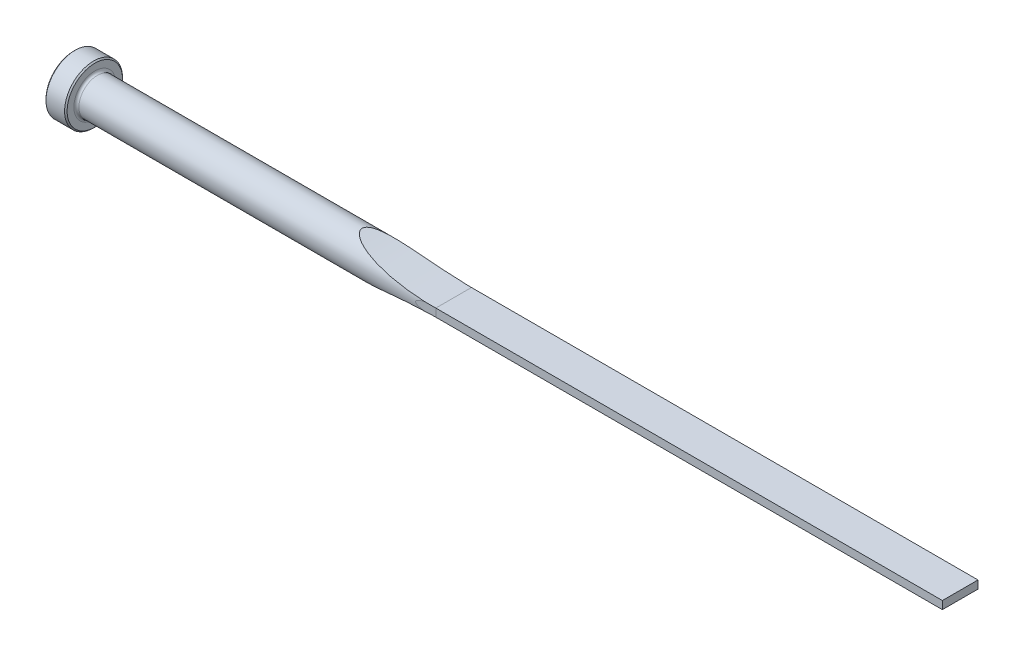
SolidWorks part; units mm, degrees
ref_plane "Front Plane" through (0, 0, 0) normal (0, 0, 1) x (1, 0, 0)
ref_plane "Top Plane" through (0, 0, 0) normal (0, 1, 0) x (1, 0, 0)
ref_plane "Right Plane" through (0, 0, 0) normal (1, 0, 0) x (0, 0, -1)
sketch "Sketch1" plane through (0, 0, 0) normal (0, 0, 1) x (1, 0, 0)
  line L0 (0, 0) -> (175.5286, 0) construction
  line L1 (0, 0) -> (0, 8.7249)
  line L2 (0, 8.7249) -> (6.35, 8.7249)
  line L3 (6.35, 8.7249) -> (6.35, 5.5562)
  line L4 (6.35, 5.5562) -> (266.7, 5.5562)
  line L5 (266.7, 5.5562) -> (266.7, 0)
  line L6 (266.7, 0) -> (0, 0)
  dimension "D1" = 266.7
  dimension "D2" = 17.4498
  dimension "D3" = 11.1125
  dimension "D4" = 6.35
revolve "Revolve1" add sketch "Sketch1" angle 360 about L0
sketch "Sketch2" plane through (0, 0, 0) normal (0, 0, 1) x (1, 0, 0)
  line L0 (266.7, 5.5562) -> (266.7, 1.1938)
  line L1 (266.7, -5.5562) -> (266.7, 5.5562) construction
  line L2 (266.7, 1.1938) -> (114.3, 1.1938)
  line L3 (266.7, 5.5562) -> (6.35, 5.5562) construction
  line L4 (86.7934, 5.5562) -> (266.7, 5.5562)
  line L5 (166.0833, 0) -> (153.1705, 0) construction
  arc A0 (114.3, 1.1938) -> (86.7934, 5.5562) centre (114.3, 90.0938) cw
  dimension "D1" = 88.9
  dimension "D3" = 152.4
  dimension "D2" = 2.3876
  dimension "D4" = 27.5066
extrude "Cut-Extrude1" cut sketch "Sketch2" against normal through all both and the other way through all
mirror "Mirror1" about plane through (0, 0, 0) normal (0, 1, 0) of "Cut-Extrude1"
sketch "Sketch3" plane through (0, 0, 0) normal (0, 1, 0) x (1, 0, 0)
  line L0 (266.7, 5.5562) -> (266.7, 5.3594)
  line L1 (266.7, 5.4265) -> (266.7, -5.4265) construction
  line L2 (266.7, 5.3594) -> (114.3, 5.3594)
  line L3 (266.7, 5.5562) -> (6.35, 5.5562) construction
  line L4 (108.3872, 5.5562) -> (266.7, 5.5562)
  line L5 (163.4716, 0) -> (166.2513, 0) construction
  line L6 (114.3, 5.4265) -> (114.3, -5.4265) construction
  arc A0 (114.3, 5.3594) -> (108.3872, 5.5562) centre (114.3, 94.2594) cw
  dimension "D2" = 88.9
  dimension "D1" = 10.7188
extrude "Cut-Extrude2" cut sketch "Sketch3" against normal through all both and the other way through all
mirror "Mirror2" about plane through (0, 0, 0) normal (0, 0, 1) of "Cut-Extrude2"
fillet "Fillet1" radius 0.762 1 edges at (6.35, 0, 5.5562)
chamfer "Chamfer1" distance 0.381 angle 45 2 edges at (0, 0, 8.7249) (6.35, 0, 8.7249)
